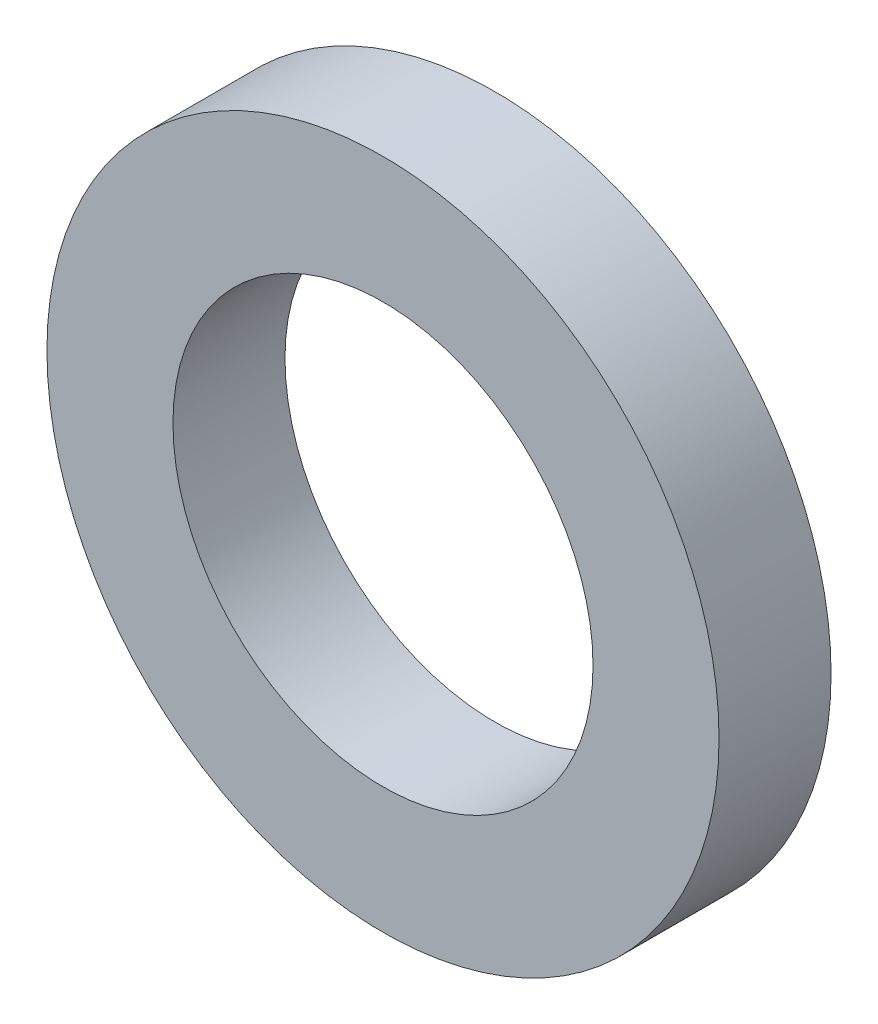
SolidWorks part; units mm, degrees
ref_plane "Face" through (0, 0, 0) normal (0, 0, 1) x (1, 0, 0)
ref_plane "Dessus" through (0, 0, 0) normal (0, 1, 0) x (1, 0, 0)
ref_plane "Droite" through (0, 0, 0) normal (1, 0, 0) x (0, 0, -1)
sketch "Esquisse1" plane through (0, 0, 0) normal (0, 0, 1) x (1, 0, 0)
  circle A0 centre (0, 0) radius 6
  circle A1 centre (0, 0) radius 3.75
  dimension "D1" = 12
  dimension "D2" = 7.5
extrude "Extrusion1" add sketch "Esquisse1" against normal blind 2
